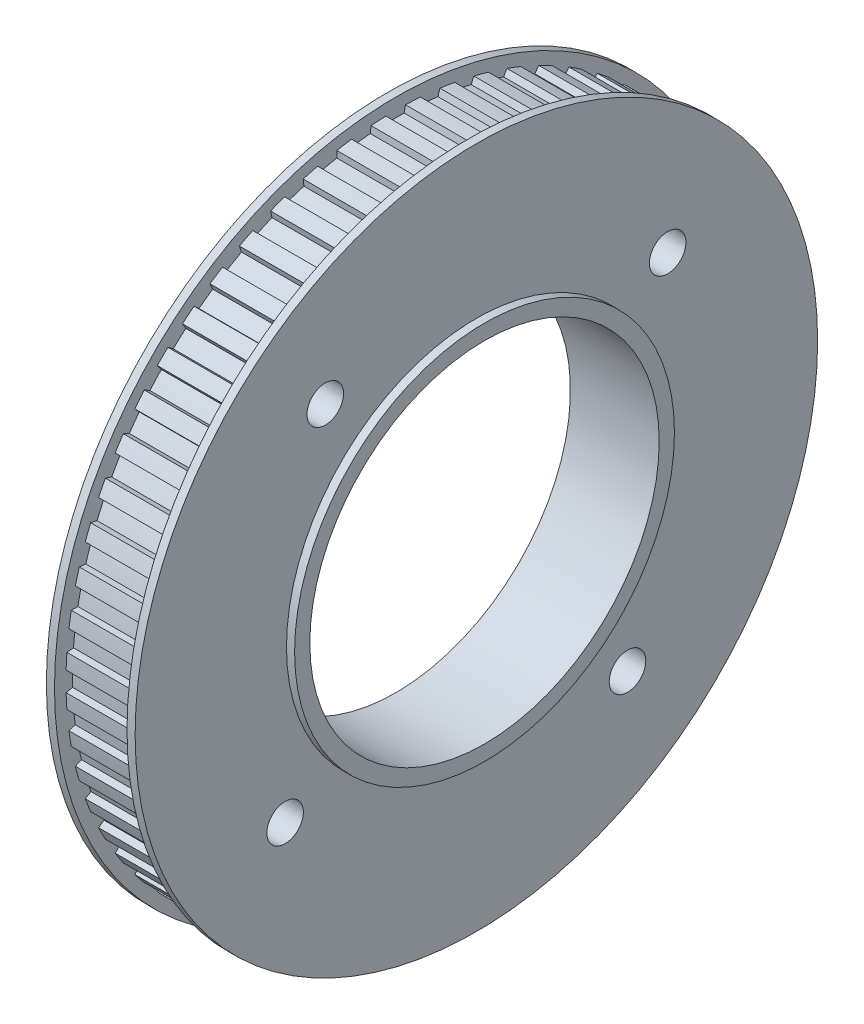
SolidWorks part; units mm, degrees
ref_plane "Face" through (0, 0, 0) normal (0, 0, 1) x (1, 0, 0)
ref_plane "Dessus" through (0, 0, 0) normal (0, 1, 0) x (1, 0, 0)
ref_plane "Droite" through (0, 0, 0) normal (1, 0, 0) x (0, 0, -1)
imported_body "Importée1"
scale "Echelle1"
sketch "Esquisse1" plane through (19.7433, 0, 0) normal (1, 0, 0) x (0, 0, -1)
  circle A0 centre (0, 0) radius 46.75
  circle A1 centre (0, 0) radius 84
  dimension "D1" = 168
  dimension "D2" = 93.5
extrude "Extrusion1" add sketch "Esquisse1" along normal blind 2
sketch "Esquisse2" plane through (1.8933, 0, 0) normal (-1, 0, 0) x (0, 0, 1)
  circle A0 centre (0, 0) radius 46.75 construction
  circle A1 centre (0, 0) radius 84
  circle A2 centre (0, 0) radius 84
  circle A3 centre (0, 0) radius 46.75
  dimension "D1" = 0
extrude "Extrusion2" add sketch "Esquisse2" along normal blind 2
sketch "Esquisse3" plane through (1.8933, 0, 0) normal (-1, 0, 0) x (0, 0, 1)
  circle A0 centre (0, 0) radius 43
  dimension "D1" = 86
extrude "Enlèv. mat.-Extru.1" cut sketch "Esquisse3" against normal through all
sketch "Esquisse4" plane through (0, 0, 0) normal (0, 0, 1) x (1, 0, 0)
  line L0 (0, 0) -> (89.8546, 0) construction
  line L2 (23.7433, 55) -> (33.7433, 55)
  line L3 (23.7433, 55) -> (23.7433, 0)
  line L4 (23.7433, 0) -> (33.7433, 0)
  line L5 (33.7433, 55) -> (33.7433, 0)
  line L6 (21.7433, -84) -> (21.7433, 84) construction
  dimension "D1" = 110
  dimension "D2" = 2
  dimension "D3" = 10
revolve "Enlèvement de matière-Révolution1" cut sketch "Esquisse4" angle 360 about L0
hole_wizard "Chambrage pour vis à tête cylindrique à 6 pans creux (ou vis CHC) M81" positions "Esquisse6" profile "Esquisse5" counterbore size "M8" standard "Ansi Métrique"
sketch "Esquisse6" plane through (-0.1067, 0, 0) normal (-1, 0, 0) x (0, 0, 1)
  line L0 (0, 0) -> (-62.8088, 0) construction
  line L1 (0, 0) -> (-47.0797, 37.1955) construction
  point P0 (-47.0797, 37.1955)
  point P8 (37.1955, 47.0797)
  point P9 (47.0797, -37.1955)
  point P10 (-37.1955, -47.0797)
  dimension "D1" = 60
sketch "Esquisse5" plane through (-0.1067, 37.1955, -47.0797) normal (0, 1, 0) x (0, 0, 1)
  line L0 (0, 0) -> (0, 23.85)
  line L1 (0, 23.85) -> (4.5, 23.85)
  line L3 (4.5, 23.85) -> (4.5, 10)
  line L4 (4.5, 10) -> (7.5, 10)
  line L5 (7.5, 10) -> (7.5, 0)
  line L7 (7.5, 0) -> (0, 0)
  line L11 (0, -6.35) -> (0, 107.95) construction
  dimension "Diamètre du perçage jusqu'au prochain" = 9
  dimension "Profondeur du perçage jusqu'au prochain" = 23.85
  dimension "Diamètre du chambrage" = 15
  dimension "Profondeur du chambrage" = 10
